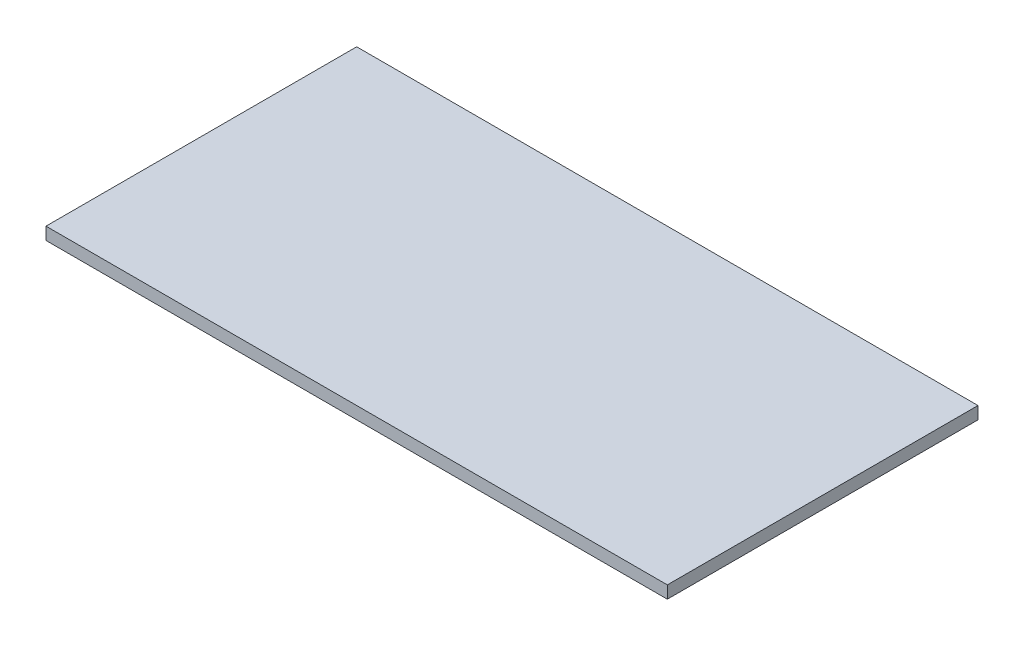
SolidWorks part; units mm, degrees
ref_plane "Plan de face" through (0, 0, 0) normal (0, 0, 1) x (1, 0, 0)
ref_plane "Plan de dessus" through (0, 0, 0) normal (0, 1, 0) x (1, 0, 0)
ref_plane "Plan de droite" through (0, 0, 0) normal (1, 0, 0) x (0, 0, -1)
sketch "Esquisse1" plane through (0, 0, 0) normal (0, 1, 0) x (1, 0, 0)
  line L0 (0, 60.8741) -> (0, -85.8664) construction
  line L1 (-300, 125) -> (200, 125)
  line L2 (-300, 125) -> (-300, -125)
  line L3 (-300, -125) -> (200, -125)
  line L4 (200, 125) -> (200, -125)
  line L5 (-73.5488, 0) -> (104.9677, 0) construction
  dimension "D1" = 500
  dimension "D2" = 250
  dimension "D3" = 300
extrude "Extrusion1" add sketch "Esquisse1" against normal blind 10
